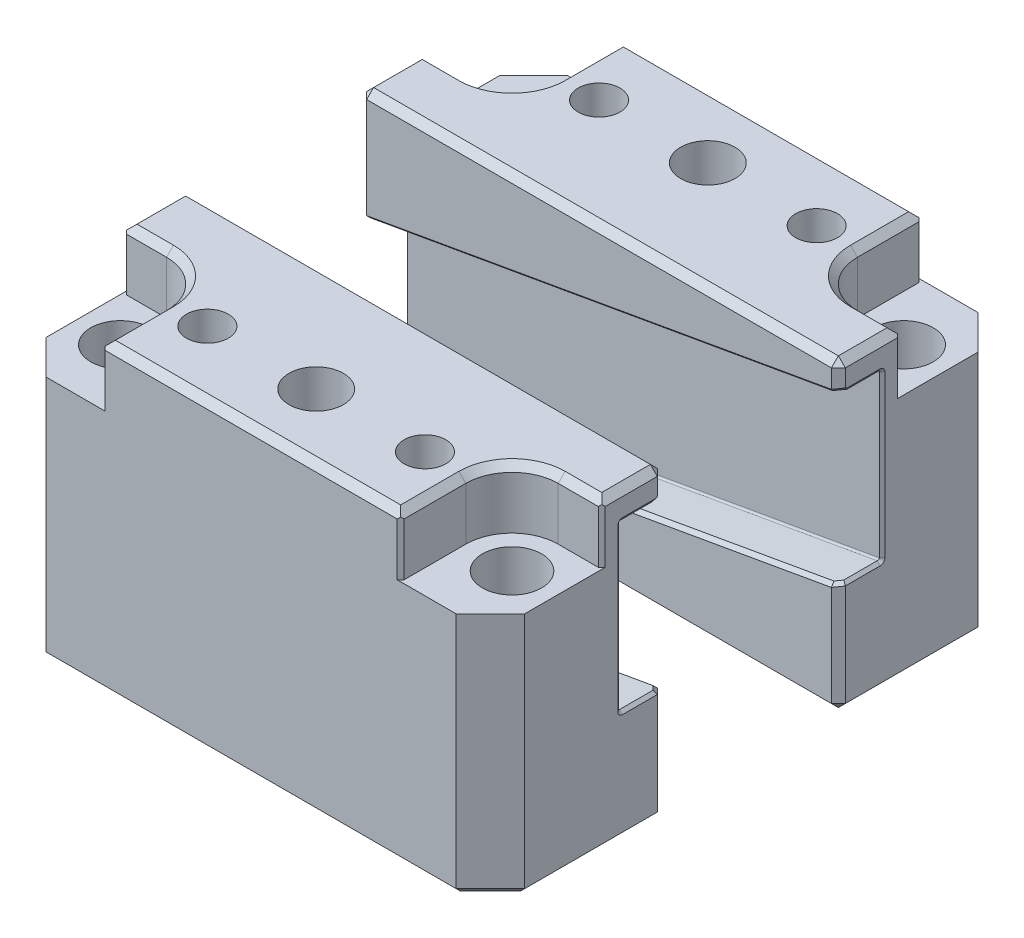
SolidWorks part; units mm, degrees
ref_plane "Front Plane" through (0, 0, 0) normal (0, 0, 1) x (1, 0, 0)
ref_plane "Top Plane" through (0, 0, 0) normal (0, 1, 0) x (1, 0, 0)
ref_plane "Right Plane" through (0, 0, 0) normal (1, 0, 0) x (0, 0, -1)
sketch "Sketch1" plane through (0, 0, 0) normal (1, 0, 0) x (0, 0, -1)
  line L0 (-12.7, 0) -> (-12.7, 44.45)
  line L1 (-12.7, 44.45) -> (-38.0746, 44.45)
  line L2 (-38.0746, 44.45) -> (-38.0746, 0)
  line L3 (-38.0746, 0) -> (-12.7, 0)
  line L4 (0, 48.255) -> (0, -16.2311) construction
  dimension "D1" = 25.4
  dimension "D2" = 44.45
  dimension "D3" = 76.1492
  dimension "D4" = 25.3746
extrude "Boss-Extrude1" add sketch "Sketch1" along normal mid plane 69.85
hole_wizard "CBORE for 5/16 Socket Head Cap Screw1" positions "Sketch4" profile "Sketch3" counterbore size "5/16" standard "ANSI Inch"
sketch "Sketch4" plane through (0, 44.45, 0) normal (0, 1, 0) x (1, 0, 0)
  line L0 (0, 7.4267) -> (0, -36.2312) construction
  line L2 (-19.6518, 0) -> (14.0148, 0) construction
  point P0 (-28.575, -28.575)
  point P11 (28.575, -28.575)
  dimension "D1" = 57.15
  dimension "D2" = 57.15
sketch "Sketch3" plane through (-28.575, 44.45, 28.575) normal (1, 0, 0) x (0, 0, 1)
  line L0 (0, 0) -> (0, 44.45)
  line L1 (0, 44.45) -> (4.2164, 44.45)
  line L3 (4.2164, 44.45) -> (4.2164, 8.6995)
  line L4 (4.2164, 8.6995) -> (6.7475, 8.6995)
  line L5 (6.7475, 8.6995) -> (6.7475, 0)
  line L7 (6.7475, 0) -> (0, 0)
  line L11 (0, -6.35) -> (0, 107.95) construction
  dimension "Thru Hole Dia." = 8.4328
  dimension "Thru Hole Depth" = 44.45
  dimension "C'Bore Dia." = 13.495
  dimension "C'Bore Depth" = 8.6995
hole_wizard "3/8-16 Tapped Hole3" positions "Sketch6" profile "Sketch5" tap size "3/8-16" standard "ANSI Inch"
sketch "Sketch6" plane through (0, 44.45, 0) normal (0, 1, 0) x (1, 0, 0)
  line L0 (0, 2.7703) -> (0, -32.9614) construction
  line L2 (-8.3627, 0) -> (4.6629, 0) construction
  line L4 (28.575, -28.575) -> (-28.575, -28.575) construction
  point P2 (0, -28.575)
sketch "Sketch5" plane through (0, 44.45, 28.575) normal (1, 0, 0) x (0, 0, 1)
  line L0 (0, 0) -> (0, 30.5787)
  line L1 (0, 30.5787) -> (3.9687, 28.194)
  line L2 (3.9687, 28.194) -> (3.9687, 0)
  line L5 (3.9687, 0) -> (0, 0)
  line L10 (0, 30.5787) -> (-3.9688, 28.194) construction
  line L11 (0, -6.35) -> (0, 107.95) construction
  dimension "Tap Drill Dia." = 7.9375
  dimension "Tap Drill Depth" = 28.194
  dimension "Drill Angle" = 118
chamfer "Chamfer1" distance 5 angle 45 2 edges at (34.925, 22.225, 38.0746) (-34.925, 22.225, 38.0746)
ref_plane "Plane3" through (0, 0, 28.575) normal (0, 0, 1) x (1, 0, 0)
sketch "Sketch17" plane through (0, 0, 28.575) normal (0, 0, 1) x (1, 0, 0)
  line L0 (-18.923, 44.45) -> (-18.923, 12.7763)
  line L1 (-18.923, 12.7763) -> (-19.05, 12.7)
  line L2 (-19.05, 12.7) -> (-19.05, 0)
  line L3 (-19.05, 0) -> (-15.875, 0)
  line L4 (-15.875, 0) -> (-15.875, 44.45)
  line L5 (-15.875, 44.45) -> (-18.923, 44.45)
  line L6 (-15.875, 49.262) -> (-15.875, -4.206) construction
  line L7 (29.925, 0) -> (-29.925, 0) construction
  line L8 (29.925, 44.45) -> (-29.925, 44.45) construction
  line L9 (0, 0) -> (0, 50.5349) construction
  line L10 (0, 16.256) -> (0, 44.45) construction
  dimension "D1" = 12.7
  dimension "D2" = 59
  dimension "D3" = 6.35
  dimension "D4" = 6.096
  dimension "D5" = 31.75
revolve "Cut-Revolve2" cut sketch "Sketch17" angle 360 about L6
mirror "Mirror1" about plane through (0, 0, 0) normal (1, 0, 0) of "Cut-Revolve2"
sketch "Sketch8" plane through (0, 44.45, 0) normal (0, 1, 0) x (1, 0, 0)
  line L0 (0, 0) -> (0, -47.9954) construction
  line L2 (-28.575, -21.8275) -> (-34.925, -21.8275)
  line L3 (-34.925, -12.7) -> (-34.925, -26.2932) construction
  line L4 (-34.925, -21.8275) -> (-34.925, -38.0746)
  line L5 (-34.925, -38.0746) -> (-21.8275, -38.0746)
  line L6 (29.925, -38.0746) -> (-29.925, -38.0746) construction
  line L7 (-21.8275, -38.0746) -> (-21.8275, -28.575)
  line L8 (21.8275, -38.0746) -> (21.8275, -28.575)
  line L9 (34.925, -38.0746) -> (21.8275, -38.0746)
  line L10 (34.925, -21.8275) -> (34.925, -38.0746)
  line L11 (28.575, -21.8275) -> (34.925, -21.8275)
  arc A0 (-34.925, -30.8568) -> (-34.925, -26.2932) centre (-28.575, -28.575) ccw construction
  arc A1 (-34.925, -30.8568) -> (-34.925, -26.2932) centre (-28.575, -28.575) ccw construction
  arc A2 (-21.8275, -28.575) -> (-28.575, -21.8275) centre (-28.575, -28.575) ccw
  arc A3 (21.8275, -28.575) -> (28.575, -21.8275) centre (28.575, -28.575) cw
extrude "Cut-Extrude3" cut sketch "Sketch8" against normal up to surface (8.6995 mm away)
sketch "Sketch9" plane through (0, 0, 12.7) normal (0, 0, -1) x (-1, 0, 0)
  line L0 (0, 44.45) -> (0, 0) construction
  line L1 (-34.925, 44.45) -> (34.925, 44.45) construction
  line L2 (34.925, 0) -> (34.925, 44.45) construction
  line L3 (-34.925, 40.3847) -> (34.925, 28.0683)
  line L4 (-34.925, 40.3847) -> (-34.925, 16.3817)
  line L5 (-34.925, 16.3817) -> (34.925, 4.0653)
  line L6 (34.925, 28.0683) -> (34.925, 4.0653)
  line L7 (-34.925, 40.3847) -> (34.925, 4.0653) construction
  line L8 (-34.925, 16.3817) -> (34.925, 28.0683) construction
  line L9 (-10.1137, 22.225) -> (18.4449, 22.225) construction
  point P5 (0, 22.225)
  dimension "D1" = 24.003
  dimension "D2" = 10
extrude "Cut-Extrude4" cut sketch "Sketch9" against normal offset from surface (6.35 mm away) 19.05
hole_wizard "3/8-16 Tapped Hole2" positions "Sketch11" profile "Sketch10" tap size "3/8-16" standard "ANSI Inch"
sketch "Sketch11" plane through (0, 0, 0) normal (0, -1, 0) x (-1, 0, 0)
  point P0 (28.575, -28.575)
  point P3 (-28.575, -28.575)
sketch "Sketch10" plane through (-28.575, 0, 28.575) normal (1, 0, 0) x (0, 0, -1)
  line L0 (0, 0) -> (0, 44.45)
  line L1 (0, 44.45) -> (4.318, 44.45)
  line L2 (4.318, 44.45) -> (4.318, 0)
  line L5 (4.318, 0) -> (0, 0)
  line L11 (0, -6.35) -> (0, 107.95) construction
  dimension "Thru Tap Drill Dia." = 8.636
  dimension "Thru Tap Drill Depth" = 44.45
ref_plane "Plane1" through (-3.8007, 21.5548, 0) normal (-0.1736, 0.9848, 0) x (0.9848, 0.1736, 0)
fillet "Fillet1" radius 0.254 2 edges at (0, 34.2265, 19.05) (0, 10.2235, 19.05)
chamfer "Chamfer2" distance 1.016 angle 45 20 edges at (0, 0, 12.7) (34.925, 8.1909, 12.7) (34.925, 0, 22.8873) (32.425, 0, 35.5746) (0, 0, 38.0746) (-32.425, 0, 35.5746) (-34.925, 0, 22.8873) (-34.925, 2.0326, 12.7) (-23.8038, 44.45, 23.8038) (-34.925, 44.45, 17.2637) (-34.925, 36.2591, 12.7) (0, 44.45, 12.7) (23.8038, 44.45, 23.8038) (0, 44.45, 38.0746) (34.925, 44.45, 17.2637) (34.925, 42.4174, 12.7) (-21.8275, 44.45, 33.3248) (-31.75, 44.45, 21.8275) (21.8275, 44.45, 33.3248) (31.75, 44.45, 21.8275)
chamfer "Chamfer3" distance 0.508 angle 45 20 edges at (34.925, 40.3847, 16.256) (34.925, 40.3092, 18.9756) (34.925, 28.3832, 19.05) (34.925, 16.4573, 18.9756) (34.925, 16.3817, 16.256) (-34.417, 28.1579, 13.208) (34.417, 40.2951, 13.208) (0, 34.2265, 12.7) (-34.925, 28.0683, 16.256) (-34.925, 27.9927, 18.9756) (-34.925, 16.0668, 19.05) (-34.925, 4.1408, 18.9756) (-34.925, 4.0653, 16.256) (-34.417, 4.1549, 13.208) (0, 10.2235, 12.7) (34.417, 16.2921, 13.208) (-34.925, 39.5923, 21.8275) (-21.8275, 39.5923, 38.0746) (21.8275, 39.5922, 38.0746) (34.925, 39.5923, 21.8275)
ref_plane "Plane2" through (19.05, 0, 0) normal (1, 0, 0) x (0, 0, -1)
sketch "Sketch19" plane through (19.05, 0, 0) normal (1, 0, 0) x (0, 0, -1)
  line L0 (-19.05, 0) -> (-19.05, 8.8176) construction
  line L1 (-19.05, 4.93) -> (-17.55, 4.064)
  line L2 (-17.55, 4.064) -> (-17.55, 0)
  line L3 (-17.55, 0) -> (-19.05, 0)
  line L4 (-19.05, 0) -> (-19.05, 4.93)
  line L5 (-13.716, 0) -> (-32.6538, 0) construction
  line L6 (-28.575, 15.5067) -> (-28.575, -15.5067) construction
  dimension "D1" = 60
  dimension "D2" = 4.064
  dimension "D3" = 3
  dimension "D4" = 9.525
revolve "Cut-Revolve3" cut sketch "Sketch19" angle 360 about L0
chamfer "Chamfer4" distance 0.508 angle 45 2 edges at (19.05, 0, 28.575) (-19.05, 0, 28.575)
mirror "Mirror2" about plane through (0, 0, 0) normal (0, 0, 1)
